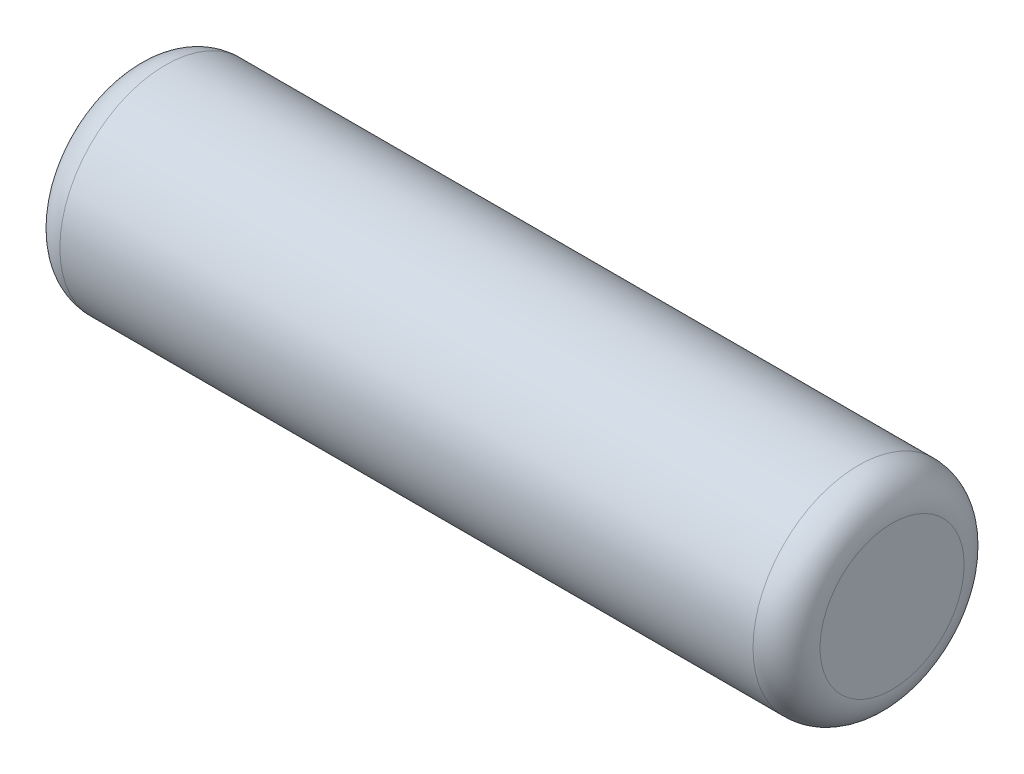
SolidWorks part; units mm, degrees
ref_plane "Front Plane" through (0, 0, 0) normal (0, 0, 1) x (1, 0, 0)
ref_plane "Top Plane" through (0, 0, 0) normal (0, 1, 0) x (1, 0, 0)
ref_plane "Right Plane" through (0, 0, 0) normal (1, 0, 0) x (0, 0, -1)
sketch "Sketch1" plane through (0, 0, 0) normal (1, 0, 0) x (0, 0, -1)
  circle A0 centre (0, 0) radius 12.75
  circle A1 centre (0, 0) radius 15.75
  dimension "D1" = 25.5
  dimension "D2" = 3
extrude "Boss-Extrude1" add sketch "Sketch1" along normal blind 110
sketch "Sketch2" plane through (110, 0, 0) normal (1, 0, 0) x (0, 0, -1)
  circle A0 centre (0, 0) radius 15.75 construction
  circle A1 centre (0, 0) radius 15.75
extrude "Boss-Extrude2" add sketch "Sketch2" along normal blind 3
fillet "Fillet1" radius 5 1 edges at (113, 0, -15.75)
fillet "Fillet2" radius 5 1 edges at (110, 0, -12.75)
fillet "Fillet3" radius 5 1 edges at (0, 0, -15.75)
